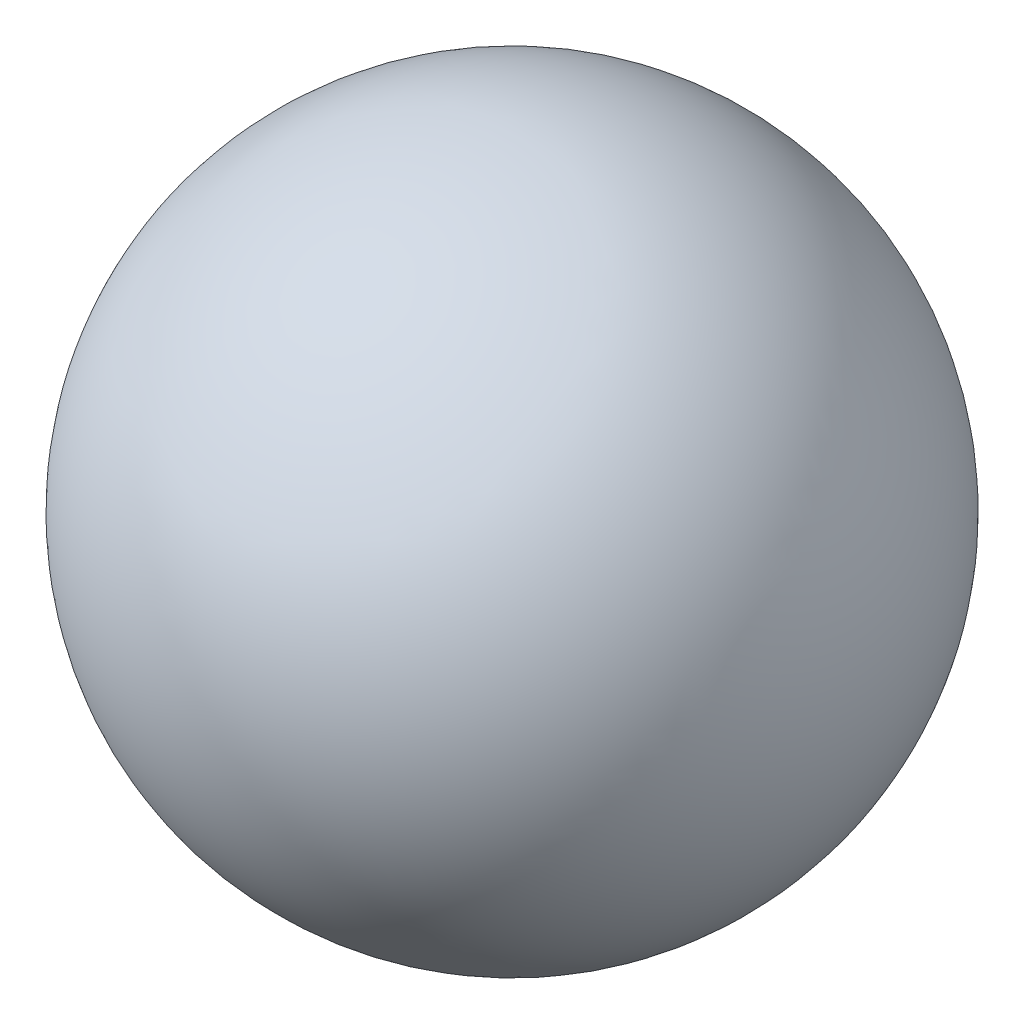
SolidWorks part; units mm, degrees
ref_plane "Plan de face" through (0, 0, 0) normal (0, 0, 1) x (1, 0, 0)
ref_plane "Plan de dessus" through (0, 0, 0) normal (0, 1, 0) x (1, 0, 0)
ref_plane "Plan de droite" through (0, 0, 0) normal (1, 0, 0) x (0, 0, -1)
sketch "Esquisse1" plane through (0, 0, 0) normal (0, 0, 1) x (1, 0, 0)
  line L0 (0, 0) -> (0, 43.8059) construction
  line L1 (0, 0) -> (18, 0) construction
  line L2 (0, 0) -> (-18, 0) construction
  line L3 (18, 0) -> (-18, 0)
  arc A0 (18, 0) -> (-18, 0) centre (0, 0) cw
  dimension "D3" = 18
  dimension "D1" = 18
  dimension "D2" = 18
revolve "Révolution1" add sketch "Esquisse1" angle 360 about L3
